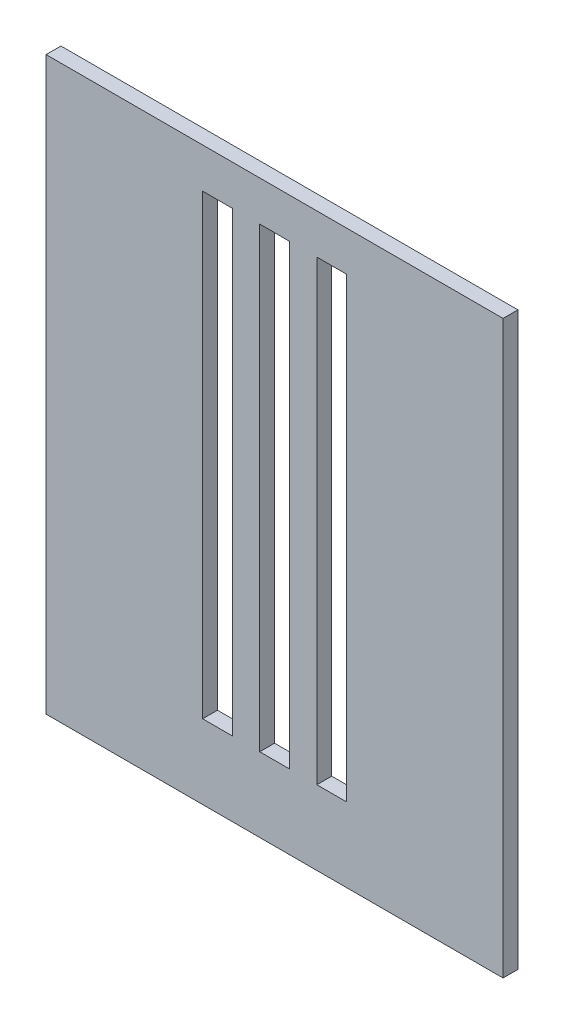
SolidWorks part; units mm, degrees
ref_plane "Front Plane" through (0, 0, 0) normal (0, 0, 1) x (1, 0, 0)
ref_plane "Top Plane" through (0, 0, 0) normal (0, 1, 0) x (1, 0, 0)
ref_plane "Right Plane" through (0, 0, 0) normal (1, 0, 0) x (0, 0, -1)
ref_plane "Front Plane-Chute_Master" through (0, 0, 0) normal (0, 0, 1) x (1, 0, 0)
ref_plane "Top Plane-Chute_Master" through (0, 0, 0) normal (0, 1, 0) x (1, 0, 0)
ref_plane "Right Plane-Chute_Master" through (0, 0, 0) normal (1, 0, 0) x (0, 0, -1)
sketch "Sketch1-Chute_Master" plane through (0, 0, 0) normal (0, 0, 1) x (1, 0, 0)
  line L1 (50.8, -31.75) -> (-50.8, -31.75) construction
  line L2 (50.8, -31.75) -> (50.8, 31.75) construction
  line L3 (50.8, 31.75) -> (-50.8, 31.75) construction
  line L4 (-50.8, -31.75) -> (-50.8, 31.75) construction
  line L5 (50.8, -31.75) -> (-50.8, 31.75) construction
  line L6 (50.8, 31.75) -> (-50.8, -31.75) construction
  point P0 (0, 0)
  dimension "D1" = 63.5
  dimension "D2" = 101.6
sketch "Sketch2-Chute_Master" plane through (0, 0, 0) normal (0, 1, 0) x (1, 0, 0)
  line L1 (-38.1, 0) -> (38.1, 0) construction
  line L2 (-38.1, 0) -> (-38.1, -76.2) construction
  line L3 (-38.1, -76.2) -> (38.1, -76.2) construction
  line L4 (38.1, 0) -> (38.1, -76.2) construction
  dimension "D1" = 76.2
  dimension "D2" = 76.2
sketch "Sketch3-Chute_Master" plane through (0, 0, 0) normal (1, 0, 0) x (0, 0, -1)
  line L1 (0, 0) -> (-76.2, 0) construction
  line L2 (0, 0) -> (0, 45.72) construction
  line L3 (0, 45.72) -> (-76.2, 45.72) construction
  line L4 (-76.2, 0) -> (-76.2, 45.72) construction
  dimension "D1" = 45.72
inserted part "Chute_Master"
sketch "Sketch2" plane through (0, 0, 0) normal (0, 0, 1) x (1, 0, 0)
  line L0 (50.8, -31.75) -> (50.8, 31.75) construction
  line L1 (-50.8, -31.75) -> (50.8, -31.75)
  line L2 (-50.8, -31.75) -> (-50.8, 95.25)
  line L3 (-50.8, 95.25) -> (50.8, 95.25)
  line L4 (50.8, -31.75) -> (50.8, 95.25)
  dimension "D1" = 127
extrude "Boss-Extrude1" add sketch "Sketch2" along normal blind 3.302
sketch "Sketch4" plane through (0, 0, 0) normal (0, 0, -1) x (-1, 0, 0)
  line L0 (9.398, 86.36) -> (16.002, 86.36)
  line L1 (-3.302, 86.36) -> (3.302, 86.36)
  line L2 (-3.302, 86.36) -> (-3.302, -15.24)
  line L3 (-3.302, -15.24) -> (3.302, -15.24)
  line L4 (3.302, 86.36) -> (3.302, -15.24)
  line L5 (9.398, 86.36) -> (9.398, -15.24)
  line L6 (-50.8, -31.75) -> (-50.8, 95.25) construction
  line L7 (9.398, -15.24) -> (16.002, -15.24)
  line L8 (-50.8, -31.75) -> (50.8, -31.75) construction
  line L9 (16.002, 86.36) -> (16.002, -15.24)
  line L10 (0, 41.91) -> (0, -41.91) construction
  line L11 (-16.002, 86.36) -> (-16.002, -15.24)
  line L12 (-9.398, -15.24) -> (-16.002, -15.24)
  line L13 (-9.398, 86.36) -> (-9.398, -15.24)
  line L14 (-9.398, 86.36) -> (-16.002, 86.36)
  point P6 (0, 86.36)
  point P14 (12.7, 86.36)
  point P20 (-12.7, 86.36)
  dimension "D1" = 50.8
  dimension "D2" = 6.604
  dimension "D3" = 101.6
  dimension "D4" = 16.51
  dimension "D5" = 2
extrude "Cut-Extrude1" cut sketch "Sketch4" against normal up to next
equation "\"thick\"= 0.125in"
